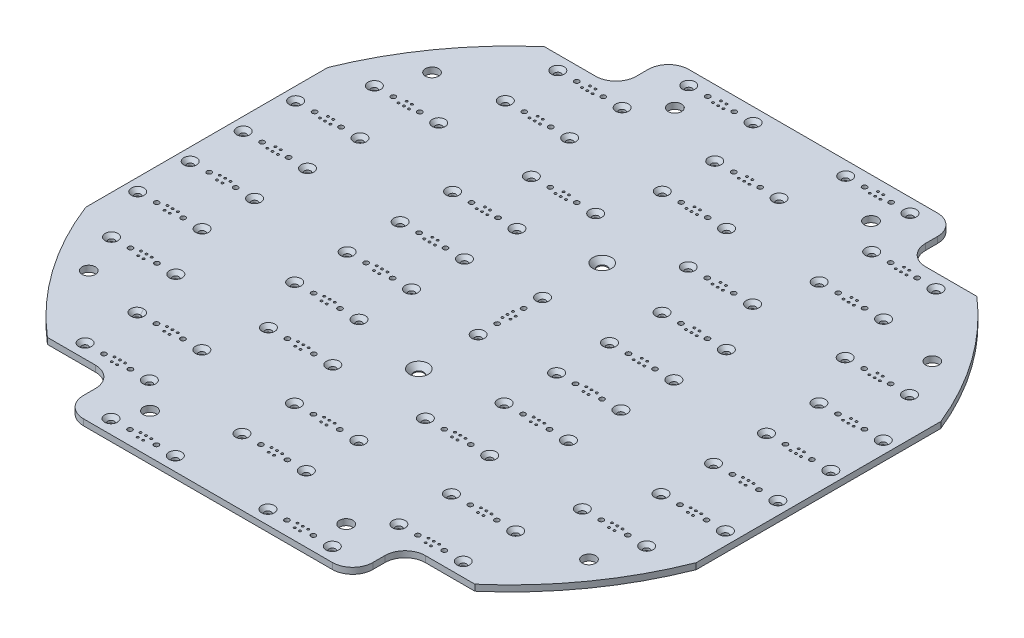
SolidWorks part; units mm, degrees
ref_plane "Front Plane" through (0, 0, 0) normal (0, 0, 1) x (1, 0, 0)
ref_plane "Top Plane" through (0, 0, 0) normal (0, 1, 0) x (1, 0, 0)
ref_plane "Right Plane" through (0, 0, 0) normal (1, 0, 0) x (0, 0, -1)
sketch "Sketch2" plane through (0, 0, 0) normal (0, 1, 0) x (1, 0, 0)
  line L0 (-204.3861, 0) -> (210.1774, 0) construction
  line L1 (-64.4398, 156.718) -> (-40.64, 156.718)
  line L2 (-74.93, 146.2278) -> (-74.93, 140.0302)
  line L3 (-64.4398, -156.718) -> (-40.64, -156.718)
  line L4 (74.93, 146.2278) -> (74.93, 140.0302)
  line L5 (-74.93, 156.718) -> (74.93, -156.718) construction
  line L6 (-74.93, -156.718) -> (74.93, 156.718) construction
  line L7 (-40.64, 156.718) -> (0, 156.718)
  line L8 (-158.75, 64.1266) -> (-158.75, 40.0044)
  line L9 (-158.75, 40.0044) -> (-158.75, -41.2756)
  line L10 (158.75, 64.1266) -> (158.75, 40.64)
  line L11 (-156.21, 75.184) -> (156.21, -75.184) construction
  line L12 (-156.21, -75.184) -> (156.21, 75.184) construction
  line L13 (85.4202, -129.54) -> (111.0649, -129.54)
  line L14 (-40.64, -156.718) -> (40.64, -156.718)
  line L15 (-111.9516, 129.54) -> (-85.4202, 129.54)
  line L16 (158.75, -40.64) -> (158.75, 40.64)
  line L17 (0, -212.4263) -> (0, 156.718) construction
  line L19 (0, 156.718) -> (40.64, 156.718)
  line L20 (-110.3067, -129.54) -> (-85.4202, -129.54)
  line L22 (74.93, -140.0302) -> (74.93, -146.2278)
  line L23 (-74.93, -140.0302) -> (-74.93, -146.2278)
  line L25 (85.4202, 129.54) -> (111.9516, 129.54)
  line L26 (40.64, 156.718) -> (64.4398, 156.718)
  line L29 (40.64, -156.718) -> (64.4398, -156.718)
  line L35 (-158.75, -41.2756) -> (-158.75, -61.2097)
  line L42 (158.75, -40.64) -> (158.75, -62.5656)
  arc A0 (158.75, 64.1266) -> (111.9516, 129.54) centre (0, 0) ccw
  circle A1 centre (-129.54, -88.9) radius 3.429
  arc A2 (-74.93, 140.0302) -> (-85.4202, 129.54) centre (-85.4202, 140.0302) cw
  arc A3 (-64.4398, 156.718) -> (-74.93, 146.2278) centre (-64.4398, 146.2278) ccw
  arc A4 (64.4398, 156.718) -> (74.93, 146.2278) centre (64.4398, 146.2278) cw
  arc A5 (74.93, 140.0302) -> (85.4202, 129.54) centre (85.4202, 140.0302) ccw
  circle A6 centre (-129.54, 88.9) radius 3.429
  circle A7 centre (129.54, -88.9) radius 3.429
  circle A8 centre (129.54, 88.9) radius 3.429
  circle A9 centre (0, 47.498) radius 1.5875
  circle A10 centre (0, -47.498) radius 1.5875
  arc A12 (74.93, -140.0302) -> (85.4202, -129.54) centre (85.4202, -140.0302) cw
  arc A13 (74.93, -146.2278) -> (64.4398, -156.718) centre (64.4398, -146.2278) cw
  arc A14 (-64.4398, -156.718) -> (-74.93, -146.2278) centre (-64.4398, -146.2278) cw
  arc A15 (-74.93, -140.0302) -> (-85.4202, -129.54) centre (-85.4202, -140.0302) ccw
  arc A36 (-158.75, 64.1266) -> (-111.9516, 129.54) centre (0, 0) cw
  arc A38 (158.75, -62.5656) -> (111.0649, -129.54) centre (0, 0) cw
  arc A39 (-158.75, -61.2097) -> (-110.3067, -129.54) centre (0, 0) ccw
  point P0 (0, 0)
  point P6 (0, 0)
  point P43 (74.93, 129.54)
  dimension "D7" = 129.54
  dimension "D10" = 88.9
  dimension "D11" = 129.54
  dimension "D14" = 3.175
  dimension "D8" = 6.858
  dimension "D1" = 313.436
  dimension "D2" = 149.86
  dimension "D3" = 312.42
  dimension "D4" = 259.08
  dimension "D5" = 317.5
  dimension "D6" = 150.368
  dimension "D9" = 47.498
  dimension "D12" = 47.498
  dimension "D13" = 129.54
extrude "Boss-Extrude2" add sketch "Sketch2" along normal blind 3.175
sketch "Sketch8" plane through (0, 3.175, 0) normal (0, 1, 0) x (1, 0, 0)
  line L0 (0.0254, -17.5873) -> (0.0254, 18.1729) construction
  line L1 (5.1853, -0.1016) -> (-6.3366, -0.1016) construction
  line L2 (0, 40.64) -> (0, -40.64) construction
  line L3 (-13.589, 40.64) -> (13.589, 40.64) construction
  line L4 (-13.589, 40.64) -> (-13.589, -40.64) construction
  line L5 (-13.589, -40.64) -> (13.589, -40.64) construction
  line L6 (13.589, 40.64) -> (13.589, -40.64) construction
  circle A0 centre (-1.397, -0.1016) radius 0.5715
  circle A1 centre (-1.397, 2.6416) radius 0.5715
  circle A2 centre (-1.397, -2.8448) radius 0.5715
  circle A3 centre (1.4478, 1.27) radius 0.5715
  circle A4 centre (1.4478, -1.4732) radius 0.5715
  circle A5 centre (0.0254, 6.7564) radius 1.2446
  circle A6 centre (0.0254, -6.9596) radius 1.2446
  circle A7 centre (0.0254, 16.5608) radius 1.5621
  circle A8 centre (0.0254, -16.764) radius 1.5621
  circle A9 centre (0, 47.498) radius 1.5875 construction
  circle A10 centre (0, -47.498) radius 1.5875 construction
  dimension "D1" = 1.143
  dimension "D3" = 2.7432
  dimension "D4" = 1.4224
  dimension "D6" = 2.4892
  dimension "D7" = 6.858
  dimension "D8" = 3.1242
  dimension "D9" = 16.6624
  dimension "D10" = 0.0254
  dimension "D2" = 1.4224
  dimension "D5" = 1.3716
  dimension "D11" = 81.28
  dimension "D12" = 27.178
  dimension "D13" = 33.8836
  dimension "D14" = 13.5636
  dimension "D15" = 40.64
  dimension "D16" = 0.1016
  dimension "D17" = 6.858
  dimension "D18" = 6.858
extrude "7W2 footprint, vertical" cut sketch "Sketch8" against normal through all
sketch "Sketch3" plane through (0, 3.175, 0) normal (0, 1, 0) x (1, 0, 0)
  line L1 (-94.869, 0) -> (-13.589, 0) construction
  line L2 (-37.6682, -13.6144) -> (-70.993, -13.6144) construction
  line L3 (-57.0738, -12.192) -> (-51.5874, -12.192) construction
  line L4 (-94.869, 0) -> (-94.869, -27.178) construction
  line L5 (-94.869, -27.178) -> (-13.589, -27.178) construction
  line L6 (-54.3306, -12.192) -> (-54.3306, 12.004) construction
  line L7 (-13.589, 0) -> (-13.589, -27.178) construction
  line L8 (-94.869, 0) -> (-13.589, -27.178) construction
  line L9 (-94.869, -27.178) -> (-13.589, 0) construction
  circle A0 centre (-47.4726, -13.6144) radius 1.2446
  circle A1 centre (-57.0738, -12.192) radius 0.5715
  circle A2 centre (-54.3306, -12.192) radius 0.5715
  circle A3 centre (-51.5874, -12.192) radius 0.5715
  circle A4 centre (-55.7022, -15.0368) radius 0.5715
  circle A5 centre (-52.959, -15.0368) radius 0.5715
  circle A6 centre (-61.1886, -13.6144) radius 1.2446
  circle A7 centre (-37.6682, -13.6144) radius 1.5621
  circle A8 centre (-70.993, -13.6144) radius 1.5621
  point P0 (-54.3306, -13.6144)
  point P1 (-54.229, -13.589)
  point P2 (-54.229, -13.589)
  dimension "D3" = 1.4224
  dimension "D4" = 2.7432
  dimension "D5" = 2.7432
  dimension "D6" = 1.4224
  dimension "D11" = 54.229
  dimension "D12" = 13.6144
  dimension "D13" = 0.1016
  dimension "D14" = 0.0254
  dimension "D15" = 27.178
  dimension "D9" = 6.858
  dimension "D10" = 16.6624
  dimension "D16" = 81.28
  dimension "D1" = 1.143
  dimension "D7" = 2.4892
  dimension "D8" = 3.1242
  dimension "D2" = 1.3716
  dimension "D17" = 33.8836
  dimension "D18" = 13.5636
extrude "7W2 footprint, horizontal" cut sketch "Sketch3" against normal through all
sketch3d "3DSketch1"
  line L0 (-54.3306, 3.175, 12.192) -> (-54.3306, 3.175, -12.2401) construction
  line L1 (-54.3306, 0, 12.192) -> (-54.3306, 3.175, 12.192) construction
  line L2 (-61.1886, 3.175, 13.6144) -> (-47.4726, 3.175, 13.6144) construction
  line L3 (-61.1886, 0, 13.6144) -> (-61.1886, 3.175, 13.6144) construction
  line L4 (-47.4726, 0, 13.6144) -> (-47.4726, 3.175, 13.6144) construction
  point P0 (-54.3306, 3.175, 13.6144)
  point P1 (-54.229, 3.175, 13.589)
  dimension "D1" = 0.1016
  dimension "D2" = 0.0254
other "TPattern1" parameters "D0"=54.229, "D1"=13.589, "D2"=135.509, "D3"=13.589, "D4"=54.229, "D5"=13.589, "D6"=135.509, "D7"=13.589, "D8"=135.509, "D9"=40.767, "D10"=54.229, "D11"=40.767, "D12"=54.229, "D13"=40.767, "D14"=135.509, "D15"=40.767, "D16"=121.92, "D17"=67.945, "D18"=40.64, "D19"=67.945, "D20"=40.64, "D21"=67.945, "D22"=121.92, "D23"=67.945, "D24"=81.28, "D25"=95.123, "D26"=0, "D27"=95.123, "D28"=81.28, "D29"=95.123, "D30"=81.28, "D31"=122.301, "D32"=0, "D33"=122.301, "D34"=81.28, "D35"=122.301, "D36"=40.64, "D37"=149.479, "D38"=40.64, "D39"=149.479
sketch "Sketch9" plane through (0, 3.175, 0) normal (0, 1, 0) x (1, 0, 0)
  circle A0 centre (0, 0) radius 171.2127 construction
  circle A1 centre (0, 0) radius 182.9276 construction
hole_wizard "CSK for #4 Flat Head Machine Screw3" positions "Sketch11" profile "Sketch10" countersink size "#4" standard "ANSI Inch"
sketch "Sketch11" plane through (0, 3.175, 0) normal (0, 1, 0) x (1, 0, 0)
  point P0 (0.0254, -16.764)
  point P3 (0.0254, 16.5608)
sketch "Sketch10" plane through (0.0254, 3.175, 16.764) normal (1, 0, 0) x (0, 0, 1)
  line L0 (0, 0) -> (0, 3.175)
  line L1 (0, 3.175) -> (1.6319, 3.175)
  line L2 (1.6319, 3.175) -> (1.6319, 1.9178)
  line L3 (1.6319, 1.9178) -> (3.2991, 0)
  line L5 (3.2991, 0) -> (0, 0)
  line L6 (-1.632, 1.9178) -> (-3.2991, 0) construction
  line L11 (0, -6.35) -> (0, 107.95) construction
  dimension "Thru Hole Dia." = 3.2639
  dimension "Thru Hole Depth" = 3.175
  dimension "Near C'Sink Dia." = 6.5982
  dimension "Near C'Sink Angle" = 82
hole_wizard "CSK for #4 Flat Head Machine Screw2" positions "Sketch13" profile "Sketch12" countersink size "#4" standard "ANSI Inch"
sketch "Sketch13" plane through (0, 3.175, 0) normal (0, 1, 0) x (1, 0, 0)
  point P0 (-37.6682, -13.6144)
  point P3 (-70.993, -13.6144)
  point P7 (152.0698, -13.6144)
  point P10 (118.745, -13.6144)
  point P13 (-138.684, -67.9704)
  point P16 (-105.3592, -67.9704)
  point P19 (-24.0792, -149.5044)
  point P22 (-57.404, -149.5044)
  point P25 (-70.993, -40.7924)
  point P28 (-37.6682, -40.7924)
  point P31 (-57.404, -67.9704)
  point P34 (-24.0792, -67.9704)
  point P37 (23.876, -67.9704)
  point P40 (37.465, -40.7924)
  point P43 (37.465, -13.6144)
  point P46 (-152.273, -13.6144)
  point P49 (37.465, -40.7924)
  point P52 (70.7898, -40.7924)
  point P55 (-118.9482, -13.6144)
  point P58 (70.7898, -13.6144)
  point P61 (70.7898, -40.7924)
  point P64 (57.2008, -67.9704)
  point P67 (-24.0792, -67.9704)
  point P70 (-57.404, -67.9704)
  point P73 (-118.9482, -40.7924)
  point P76 (-152.273, -40.7924)
  point P79 (118.745, -40.7924)
  point P82 (152.0698, -40.7924)
  point P85 (-37.6682, -13.6144)
  point P88 (-70.993, -13.6144)
  point P91 (-152.273, -13.6144)
  point P94 (-118.9482, -13.6144)
  point P97 (-118.9482, -40.7924)
  point P100 (-152.273, -40.7924)
  point P103 (-138.684, -67.9704)
  point P106 (-105.3592, -67.9704)
  point P109 (-64.7192, -95.1484)
  point P112 (-98.3161, -95.1484)
  point P114 (-98.044, -122.3264)
  point P117 (-64.7192, -122.3264)
  point P120 (-16.764, -122.3264)
  point P123 (-16.764, -95.1484)
  point P126 (16.5608, -95.1484)
  point P129 (16.5608, -122.3264)
  point P132 (57.2008, -149.5044)
  point P135 (23.876, -149.5044)
  point P138 (-24.0792, -149.5044)
  point P141 (-57.404, -149.5044)
  point P144 (64.516, -122.3264)
  point P147 (97.8408, -122.3264)
  point P150 (97.8408, -95.1484)
  point P153 (64.516, -95.1484)
  point P156 (105.156, -67.9704)
  point P159 (138.4808, -67.9704)
  point P162 (152.0698, -40.7924)
  point P165 (118.745, -40.7924)
  point P168 (118.745, -13.6144)
  point P171 (152.0698, -13.6144)
  point P174 (37.465, -13.6144)
  point P177 (70.7898, -13.6144)
  point P180 (-70.993, -40.7924)
  point P183 (-37.6682, -40.7924)
  point P186 (57.2008, -67.9704)
  point P189 (23.876, -67.9704)
  point P192 (16.5608, -95.1484)
  point P195 (-16.764, -95.1484)
  point P198 (-16.764, -122.3264)
  point P201 (16.5608, -122.3264)
  point P204 (64.516, -95.1484)
  point P207 (97.8408, -95.1484)
  point P210 (-64.7192, -122.3264)
  point P213 (-98.044, -122.3264)
  point P216 (57.2008, -149.5044)
  point P219 (23.876, -149.5044)
  point P222 (64.516, -122.3264)
  point P225 (97.8408, -122.3264)
  point P228 (-64.7192, -95.1484)
  point P231 (138.4808, -67.9704)
  point P236 (-98.044, -95.1484)
sketch "Sketch12" plane through (-37.6682, 3.175, 13.6144) normal (1, 0, 0) x (0, 0, 1)
  line L0 (0, 0) -> (0, 3.175)
  line L1 (0, 3.175) -> (1.6319, 3.175)
  line L2 (1.6319, 3.175) -> (1.6319, 1.9178)
  line L3 (1.6319, 1.9178) -> (3.2991, 0)
  line L5 (3.2991, 0) -> (0, 0)
  line L6 (-1.632, 1.9178) -> (-3.2991, 0) construction
  line L11 (0, -6.35) -> (0, 107.95) construction
  dimension "Thru Hole Dia." = 3.2639
  dimension "Thru Hole Depth" = 3.175
  dimension "Near C'Sink Dia." = 6.5982
  dimension "Near C'Sink Angle" = 82
hole_wizard "CSK for #10 Flat Head Machine Screw1" positions "Sketch15" profile "Sketch14" countersink size "#10" standard "ANSI Inch"
sketch "Sketch15" plane through (0, 3.175, 0) normal (0, 1, 0) x (1, 0, 0)
  point P0 (0, 47.498)
  point P3 (0, -47.498)
sketch "Sketch14" plane through (0, 3.175, -47.498) normal (1, 0, 0) x (0, 0, 1)
  line L0 (0, 0) -> (0, 3.175)
  line L1 (0, 3.175) -> (2.5527, 3.175)
  line L2 (2.5527, 3.175) -> (2.5527, 2.6882)
  line L3 (2.5527, 2.6882) -> (4.8895, 0)
  line L5 (4.8895, 0) -> (0, 0)
  line L6 (-2.5527, 2.6882) -> (-4.8895, 0) construction
  line L11 (0, -6.35) -> (0, 107.95) construction
  dimension "Thru Hole Dia." = 5.1054
  dimension "Thru Hole Depth" = 3.175
  dimension "Near C'Sink Dia." = 9.779
  dimension "Near C'Sink Angle" = 82
sketch "Sketch16" plane through (0, 3.175, 0) normal (0, 1, 0) x (1, 0, 0)
  line L0 (-116.4618, -135.9154) -> (203.0488, -135.9154) construction
  line L1 (-16.764, -122.3264) -> (97.8408, -122.3264) construction
  line L2 (-145.9992, -122.3264) -> (-16.764, -122.3264) construction
  line L3 (-199.2086, 0) -> (235.3782, 0) construction
  circle A10 centre (-50.8, -135.9154) radius 3.175
  circle A11 centre (50.8, -135.9154) radius 3.175
  circle A12 centre (50.8, 135.9154) radius 3.175
  circle A13 centre (-50.8, 135.9154) radius 3.175
  dimension "D3" = 6.35
  dimension "D1" = 0
  dimension "D2" = 13.589
  dimension "D4" = 50.8
  dimension "D5" = 50.8
extrude "Cut-Extrude1" [suppressed] cut sketch "Sketch16" against normal through all
sketch "Sketch18" plane through (0, 3.175, 0) normal (0, 1, 0) x (1, 0, 0)
  line L0 (-60.9854, 13.6144) -> (-47.2694, 13.6144) construction
  line L1 (-54.1274, 13.6144) -> (-54.1274, 10.8068) construction
  line L2 (-94.869, 27.178) -> (-13.589, 27.178) construction
  line L3 (-94.869, 27.178) -> (-94.869, 0) construction
  line L4 (-94.869, 0) -> (-13.589, 0) construction
  line L5 (-13.589, 27.178) -> (-13.589, 0) construction
  line L6 (-94.869, 27.178) -> (-13.589, 0) construction
  line L7 (-94.869, 0) -> (-13.589, 27.178) construction
  line L8 (-94.869, 0) -> (-13.589, 0) construction
  line L9 (-94.869, 0) -> (-94.869, -27.178) construction
  line L10 (-94.869, -27.178) -> (-13.589, -27.178) construction
  line L11 (-13.589, 0) -> (-13.589, -27.178) construction
  line L12 (-94.869, 0) -> (-13.589, -27.178) construction
  line L13 (-94.869, -27.178) -> (-13.589, 0) construction
  circle A0 centre (-37.465, 13.6144) radius 1.6319
  circle A1 centre (-37.6682, -13.6144) radius 1.632 construction
  circle A2 centre (-70.7898, 13.6144) radius 1.632
  circle A3 centre (-47.2694, 13.6144) radius 1.2446
  circle A4 centre (-47.4726, -13.6144) radius 1.2446 construction
  circle A5 centre (-51.3842, 12.192) radius 0.5715
  circle A6 centre (-51.5874, -12.192) radius 0.5715 construction
  circle A7 centre (-54.1274, 12.192) radius 0.5715
  circle A8 centre (-56.8706, 12.192) radius 0.5715
  circle A9 centre (-52.7558, 15.0368) radius 0.5715
  circle A10 centre (-55.499, 15.0368) radius 0.5715
  circle A11 centre (-60.9854, 13.6144) radius 1.2446
  point P18 (-54.1274, 13.6144)
  point P19 (-54.229, 13.589)
  point P20 (-54.229, 13.589)
  point P25 (-54.229, -13.589)
  dimension "D1" = 13.716
  dimension "D2" = 0.1016
  dimension "D3" = 0.0254
  dimension "D4" = 27.178
  dimension "D5" = 81.28
  dimension "D6" = 54.229
  dimension "D7" = 27.178
  dimension "D8" = 81.28
  dimension "D9" = 13.589
  dimension "D10" = 0
  dimension "D11" = 1.4224
  dimension "D12" = 1.4224
  dimension "D13" = 1.3716
  dimension "D14" = 2.7432
  dimension "D15" = 16.6624
extrude "Cut-Extrude2" cut sketch "Sketch18" against normal through all
other "TPattern2" parameters "D0"=54.229, "D1"=13.589, "D2"=135.509, "D3"=13.589, "D4"=54.229, "D5"=13.589, "D6"=135.509, "D7"=13.589, "D8"=135.509, "D9"=40.767, "D10"=54.229, "D11"=40.767, "D12"=54.229, "D13"=40.767, "D14"=135.509, "D15"=40.767, "D16"=121.92, "D17"=67.945, "D18"=40.64, "D19"=67.945, "D20"=40.64, "D21"=67.945, "D22"=121.92, "D23"=67.945, "D24"=81.28, "D25"=95.123, "D26"=0, "D27"=95.123, "D28"=81.28, "D29"=95.123, "D30"=81.28, "D31"=122.301, "D32"=0, "D33"=122.301, "D34"=81.28, "D35"=122.301, "D36"=40.64, "D37"=149.479, "D38"=40.64, "D39"=149.479
hole_wizard "CSK for #4 Flat Head Machine Screw1" positions "Sketch20" profile "Sketch19" countersink size "#4" standard "ANSI Inch"
sketch "Sketch20" plane through (0, 3.175, 0) normal (0, 1, 0) x (-1, 0, 0)
  point P0 (37.465, -13.6144)
  point P3 (70.7898, -13.6144)
  point P6 (118.745, -13.6144)
  point P9 (152.0698, -13.6144)
  point P12 (152.0698, -40.7924)
  point P15 (118.745, -40.7924)
  point P18 (70.7898, -40.7924)
  point P21 (37.465, -40.7924)
  point P24 (-37.6682, -40.7924)
  point P27 (-70.993, -40.7924)
  point P30 (-70.993, -13.6144)
  point P33 (-37.6682, -13.6144)
  point P36 (-118.9482, -13.6144)
  point P39 (-118.9482, -40.7924)
  point P42 (-152.273, -40.7924)
  point P45 (-152.273, -13.6144)
  point P48 (-138.684, -67.9704)
  point P51 (-105.3592, -67.9704)
  point P54 (-57.404, -67.9704)
  point P57 (-64.7192, -95.1484)
  point P60 (-98.044, -95.1484)
  point P63 (-24.0792, -67.9704)
  point P66 (23.876, -67.9704)
  point P69 (57.2008, -67.9704)
  point P72 (105.156, -67.9704)
  point P75 (138.4808, -67.9704)
  point P78 (97.8408, -95.1484)
  point P81 (64.516, -95.1484)
  point P84 (16.5608, -95.1484)
  point P87 (-16.764, -95.1484)
  point P90 (-98.044, -122.3264)
  point P93 (-64.7192, -122.3264)
  point P96 (-16.764, -122.3264)
  point P99 (16.5608, -122.3264)
  point P103 (64.516, -122.3264)
  point P106 (97.8408, -122.3264)
  point P109 (57.2008, -149.5044)
  point P112 (23.876, -149.5044)
  point P115 (-24.0792, -149.5044)
  point P118 (-57.404, -149.5044)
sketch "Sketch19" plane through (-37.465, 3.175, -13.6144) normal (1, 0, 0) x (0, 0, 1)
  line L0 (0, 0) -> (0, 3.175)
  line L1 (0, 3.175) -> (1.6319, 3.175)
  line L2 (1.6319, 3.175) -> (1.6319, 1.9178)
  line L3 (1.6319, 1.9178) -> (3.2991, 0)
  line L5 (3.2991, 0) -> (0, 0)
  line L6 (-1.632, 1.9178) -> (-3.2991, 0) construction
  line L11 (0, -6.35) -> (0, 107.95) construction
  dimension "Thru Hole Dia." = 3.2639
  dimension "Thru Hole Depth" = 3.175
  dimension "Near C'Sink Dia." = 6.5982
  dimension "Near C'Sink Angle" = 82
hole_wizard "I (0.272) Diameter Hole1" positions "Sketch22" profile "Sketch21" hole size "I" standard "ANSI Inch"
sketch "Sketch22" plane through (0, 3.175, 0) normal (0, 1, 0) x (1, 0, 0)
  line L0 (-64.4398, 146.2278) -> (-71.8575, 153.6455) construction
  line L1 (0, 0) -> (0, 205.4401) construction
  line L4 (0, 0) -> (-167.4964, 0) construction
  line L5 (-104.5787, 135.9154) -> (88.4599, 135.9154) construction
  arc A0 (-64.4398, 156.718) -> (-74.93, 146.2278) centre (-64.4398, 146.2278) ccw construction
  point P0 (-50.8, 135.9154)
  point P20 (50.8, 135.9154)
  point P32 (50.8, -135.9154)
  point P33 (-50.8, -135.9154)
  dimension "D1" = 135.9154
  dimension "D2" = 50.8
sketch "Sketch21" plane through (-50.8, 3.175, -135.9154) normal (1, 0, 0) x (0, 0, 1)
  line L0 (0, 0) -> (0, 3.175)
  line L1 (0, 3.175) -> (3.4544, 3.175)
  line L2 (3.4544, 3.175) -> (3.4544, 0)
  line L5 (3.4544, 0) -> (0, 0)
  line L11 (0, -6.35) -> (0, 107.95) construction
  dimension "Thru Hole Dia." = 6.9088
  dimension "Thru Hole Depth" = 3.175
